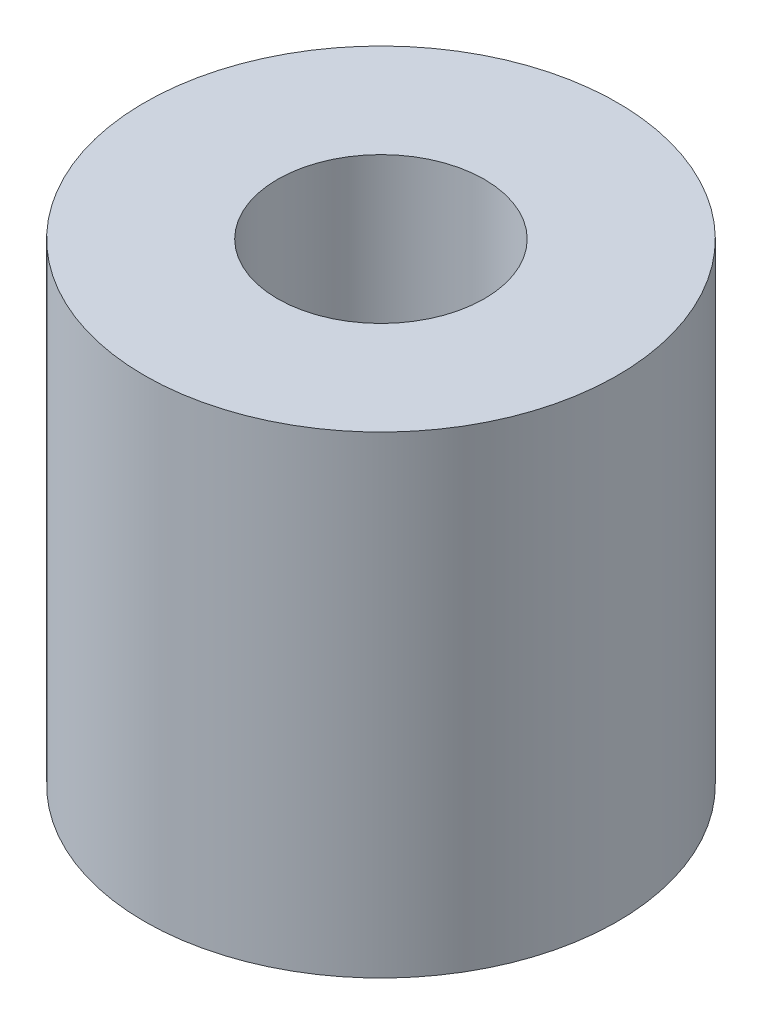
SolidWorks part; units mm, degrees
ref_plane "Front Plane" through (0, 0, 0) normal (0, 0, 1) x (1, 0, 0)
ref_plane "Top Plane" through (0, 0, 0) normal (0, 1, 0) x (1, 0, 0)
ref_plane "Right Plane" through (0, 0, 0) normal (1, 0, 0) x (0, 0, -1)
sketch "Sketch1" plane through (0, 0, 0) normal (0, 1, 0) x (1, 0, 0)
  circle A0 centre (0, 0) radius 1.75
  circle A1 centre (0, 0) radius 4
  dimension "D1" = 3.5
  dimension "D2" = 8
extrude "Boss-Extrude1" add sketch "Sketch1" along normal blind 8
